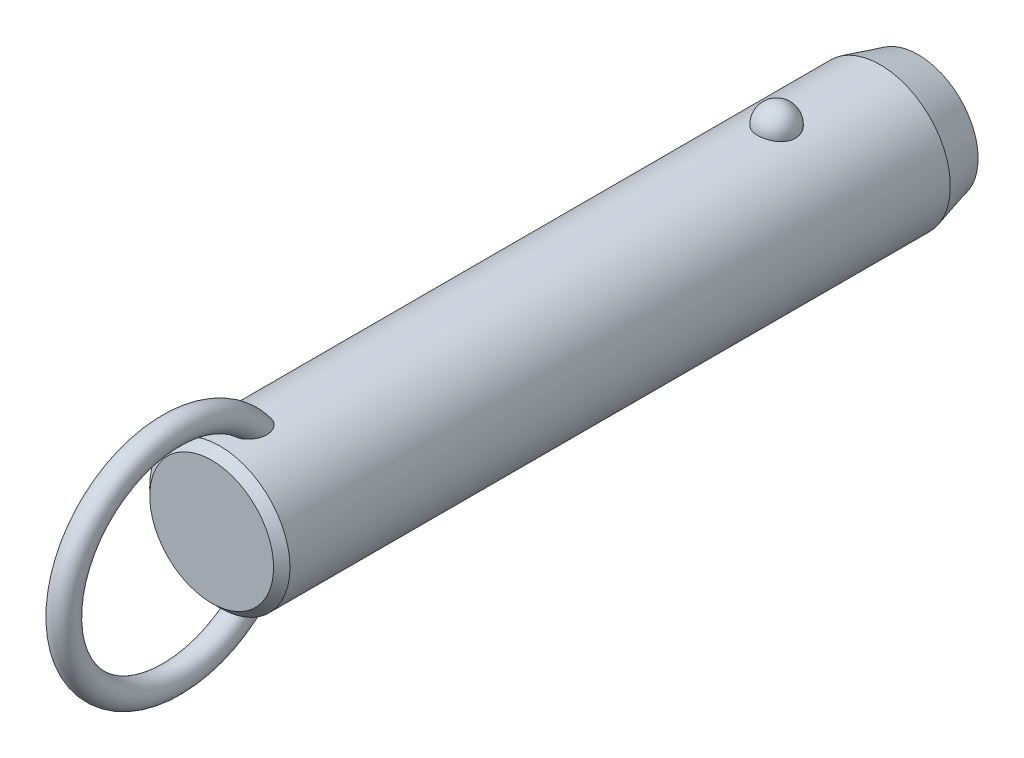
SolidWorks part; units mm, degrees
ref_plane "Front Plane" through (0, 0, 0) normal (0, 0, 1) x (1, 0, 0)
ref_plane "Top Plane" through (0, 0, 0) normal (0, 1, 0) x (1, 0, 0)
ref_plane "Right Plane" through (0, 0, 0) normal (1, 0, 0) x (0, 0, -1)
sketch "Sketch2" plane through (0, 0, 0) normal (0, 0, 1) x (1, 0, 0)
  circle A0 centre (0, 0) radius 11.1
  point P3 (0, 11.1)
  dimension "D1" = 22.2
extrude "Boss-Extrude1" add sketch "Sketch2" along normal blind 73.7
sketch "Sketch3" plane through (0, 0, 0) normal (0, 0, -1) x (-1, 0, 0)
  circle A0 centre (0, 0) radius 11.1
  dimension "D1" = 22.2
extrude "Boss-Extrude2" add sketch "Sketch3" along normal blind 25.4
chamfer "Chamfer1" distance 6 angle 15 1 edges at (-11.1, 0, -25.4)
sketch "Sketch12" plane through (0, 0, 0) normal (1, 0, 0) x (0, 0, -1)
  line L0 (-73.7, 11.1) -> (-73.7, -11.1) construction
  point P0 (-73.7, 0)
sketch "Sketch13" plane through (0, 0, 0) normal (1, 0, 0) x (0, 0, -1)
  circle A0 centre (-92.75, 0) radius 19.05
  point P2 (-73.7, 0)
  dimension "D1" = 38.1
sketch "Sketch14" plane through (0, 0, 0) normal (0, 1, 0) x (1, 0, 0)
  circle A0 centre (0, -75.7) radius 2
  point P2 (0, -73.7)
  dimension "D1" = 4
sweep "Sweep1" add profiles "Sketch14" path "Sketch13"
sketch "Sketch15" plane through (0, 0, 73.7) normal (0, 0, 1) x (1, 0, 0)
  circle A0 centre (0, 0) radius 11.1
  dimension "D1" = 22.2
extrude "Boss-Extrude3" add sketch "Sketch15" along normal blind 12.7
chamfer "Chamfer2" distance 1.3 angle 45 1 edges at (11.1, 0, 86.4)
sketch "Sketch18" plane through (0, 0, 0) normal (1, 0, 0) x (0, 0, -1)
  line L0 (19.4, 11.1) -> (-77.268, 11.1) construction
  line L1 (3, 14.1) -> (3, 8.1)
  line L2 (-77.268, -11.1) -> (19.4, -11.1) construction
  arc A0 (3, 14.1) -> (3, 8.1) centre (3, 11.1) ccw
  point P4 (0, 11.1)
  dimension "D1" = 25.2
revolve "Revolve1" add sketch "Sketch18" angle 360 about L1
